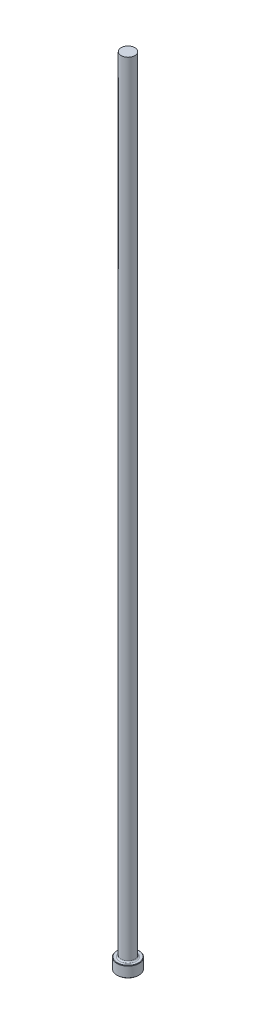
SolidWorks part; units mm, degrees
ref_plane "Front Plane" through (0, 0, 0) normal (0, 0, 1) x (1, 0, 0)
ref_plane "Top Plane" through (0, 0, 0) normal (0, 1, 0) x (1, 0, 0)
ref_plane "Right Plane" through (0, 0, 0) normal (1, 0, 0) x (0, 0, -1)
sketch "Sketch1" plane through (0, 0, 0) normal (0, 0, 1) x (1, 0, 0)
  line L0 (0, 259.9588) -> (0, -15.1925) construction
  line L1 (0, 0) -> (-6.35, 0)
  line L2 (-6.35, 0) -> (-6.35, 6.35)
  line L3 (-6.35, 6.35) -> (-3.9687, 6.35)
  line L4 (-3.9687, 6.35) -> (-3.9687, 457.2)
  line L5 (-3.9687, 457.2) -> (0, 457.2)
  line L6 (0, 457.2) -> (0, 0)
  dimension "L" = 457.2
  dimension "H" = 12.7
  dimension "T" = 6.35
  dimension "D" = 7.9375
revolve "Revolve1" add sketch "Sketch1" angle 360 about L0
chamfer "Chamfer1" distance 0.254 angle 45 2 edges at (0, 6.35, 6.35) (0, 0, 6.35)
fillet "Fillet1" radius 0.762 1 edges at (0, 6.35, 3.9687)
sketch "Pocket Sketch" plane through (0, 0, 0) normal (0, 0, 1) x (1, 0, 0)
  line L0 (-6.7469, 0) -> (-6.7469, 6.3754)
  line L1 (-6.7469, 6.3754) -> (-5.1276, 6.3754)
  line L2 (-4.3656, 7.1374) -> (-4.3656, 22.225)
  line L3 (-4.3656, 22.225) -> (0, 22.225)
  line L4 (0, 22.225) -> (0, 0)
  line L5 (0, 0) -> (-6.7469, 0)
  line L6 (0, 12.6104) -> (0, -2.4989) construction
  line L7 (-6.35, 6.096) -> (-6.35, 0.254) construction
  line L8 (6.096, 6.35) -> (-6.096, 6.35) construction
  line L9 (-3.9687, 457.2) -> (-3.9687, 7.112) construction
  line L10 (-5.1276, 6.3754) -> (-4.3656, 7.1374)
  point P3 (-4.3656, 6.3754)
  dimension "D1" = 13.4937
  dimension "D2" = 0.3969
  dimension "D3" = 0.0254
  dimension "D4" = 0.3969
  dimension "D5" = 8.7312
  dimension "D6" = 22.225
